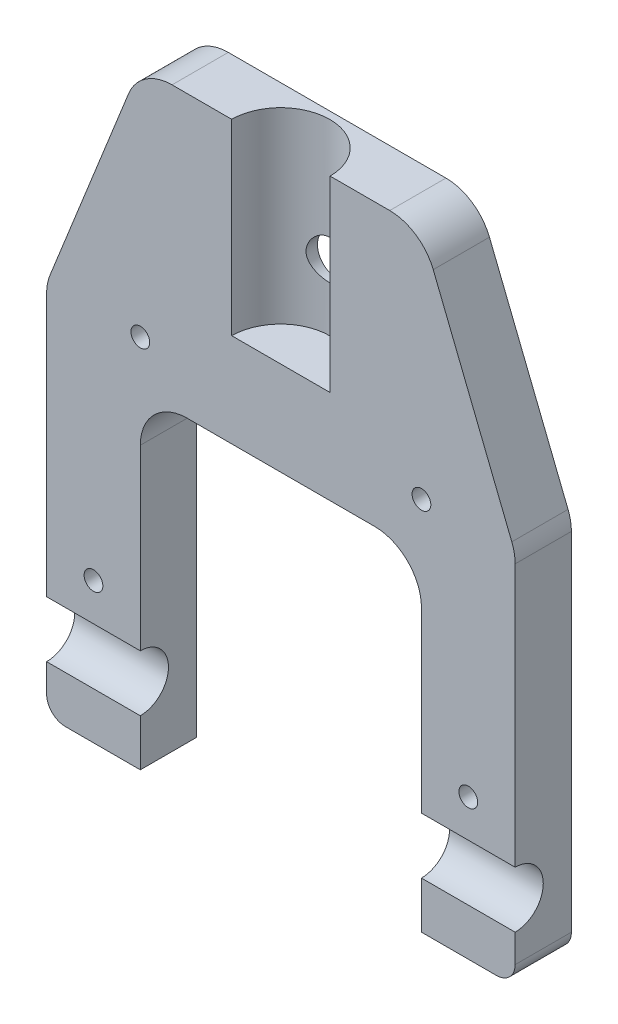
SolidWorks part; units mm, degrees
ref_plane "Plan de face" through (0, 0, 0) normal (0, 0, 1) x (1, 0, 0)
ref_plane "Plan de dessus" through (0, 0, 0) normal (0, 1, 0) x (1, 0, 0)
ref_plane "Plan de droite" through (0, 0, 0) normal (1, 0, 0) x (0, 0, -1)
sketch "Esquisse1" plane through (0, 0, 0) normal (0, 0, 1) x (1, 0, 0)
  line L0 (0, -9.4359) -> (0, 54.0267) construction
  line L1 (-9.1019, 0) -> (56.0307, 0) construction
  line L2 (50, -8.0998) -> (50, 54.0267) construction
  line L3 (10, -9.4359) -> (10, 70) construction
  line L4 (40, -8.0998) -> (40, 70) construction
  line L5 (6.2628, 35) -> (43.6722, 35) construction
  line L6 (-6.9308, 40) -> (53.3586, 40) construction
  line L7 (-3.4236, 65) -> (59.8719, 65) construction
  line L8 (0, 2) -> (0, 39.0371)
  line L9 (0.3576, 40.894) -> (8.7428, 61.857)
  line L10 (13.3852, 65) -> (36.6148, 65)
  line L11 (41.2572, 61.857) -> (49.6424, 40.894)
  line L12 (50, 39.0371) -> (50, 2)
  line L13 (48, 0) -> (2, 0)
  line L14 (25, -4.2587) -> (25, 70) construction
  line L15 (-5.5556, 15) -> (51.4147, 15) construction
  line L17 (5, 18.3834) -> (5, 11.0367) construction
  line L18 (19.7963, 52) -> (30.6725, 52) construction
  arc A0 (0, 39.0371) -> (0.3576, 40.894) centre (5, 39.0371) cw
  arc A1 (49.6424, 40.894) -> (50, 39.0371) centre (45, 39.0371) cw
  arc A2 (36.6148, 65) -> (41.2572, 61.857) centre (36.6148, 60) cw
  arc A3 (8.7428, 61.857) -> (13.3852, 65) centre (13.3852, 60) cw
  arc A4 (50, 2) -> (48, 0) centre (48, 2) cw
  arc A5 (0, 2) -> (2, 0) centre (2, 2) ccw
  circle A8 centre (25, 52) radius 2.1
  point P25 (0, 40)
  point P26 (0, 40)
  point P28 (10, 65)
  point P30 (50, 40)
  point P31 (40, 65)
  point P34 (50, 40)
  point P39 (50, 0)
  point P44 (0, 0)
  point P51 (40, 65)
  point P54 (10, 65)
  dimension "D1" = 5
  dimension "D2" = 2
extrude "Extrusion1" add sketch "Esquisse1" along normal blind 6
sketch "Esquisse4" plane through (0, 65, 0) normal (0, 1, 0) x (-1, 0, 0)
  line L0 (-25, 9.545) -> (-25, -4.9525) construction
  circle A0 centre (-25, 6.0262) radius 5.25
extrude "Enlèv. mat.-Extru.2" cut sketch "Esquisse4" against normal blind 20
sketch "Esquisse5" plane through (0, 0, 6) normal (0, 0, 1) x (1, 0, 0)
  line L0 (10, -1.5862) -> (10, 36) construction
  line L1 (40, -1.5862) -> (40, 31.8078) construction
  line L2 (-3.4851, 35) -> (52.884, 35) construction
  line L3 (2, 0) -> (48, 0) construction
  line L4 (15, 35) -> (35, 35)
  line L5 (10, 30) -> (10, 0)
  line L6 (10, 0) -> (40, 0)
  line L7 (40, 30) -> (40, 0)
  arc A0 (35, 35) -> (40, 30) centre (35, 30) cw
  arc A1 (15, 35) -> (10, 30) centre (15, 30) ccw
  point P16 (10, 35)
  dimension "D1" = 5
extrude "Enlèv. mat.-Extru.3" cut sketch "Esquisse5" against normal blind 10
sketch "Esquisse6" plane through (50, 0, 0) normal (1, 0, 0) x (0, 0, -1)
  line L0 (-10.2222, 8) -> (4.3801, 8) construction
  circle A0 centre (-6, 8) radius 3
extrude "Enlèv. mat.-Extru.4" cut sketch "Esquisse6" against normal through all
sketch "Esquisse7" plane through (0, 0, 6) normal (0, 0, 1) x (1, 0, 0)
  line L0 (25, 30.124) -> (25, -6.0246) construction
  circle A0 centre (5, 15) radius 1
  circle A1 centre (10, 40) radius 1
  circle A2 centre (45, 15) radius 1
  circle A3 centre (40, 40) radius 1
extrude "Enlèv. mat.-Extru.5" cut sketch "Esquisse7" against normal blind 3
